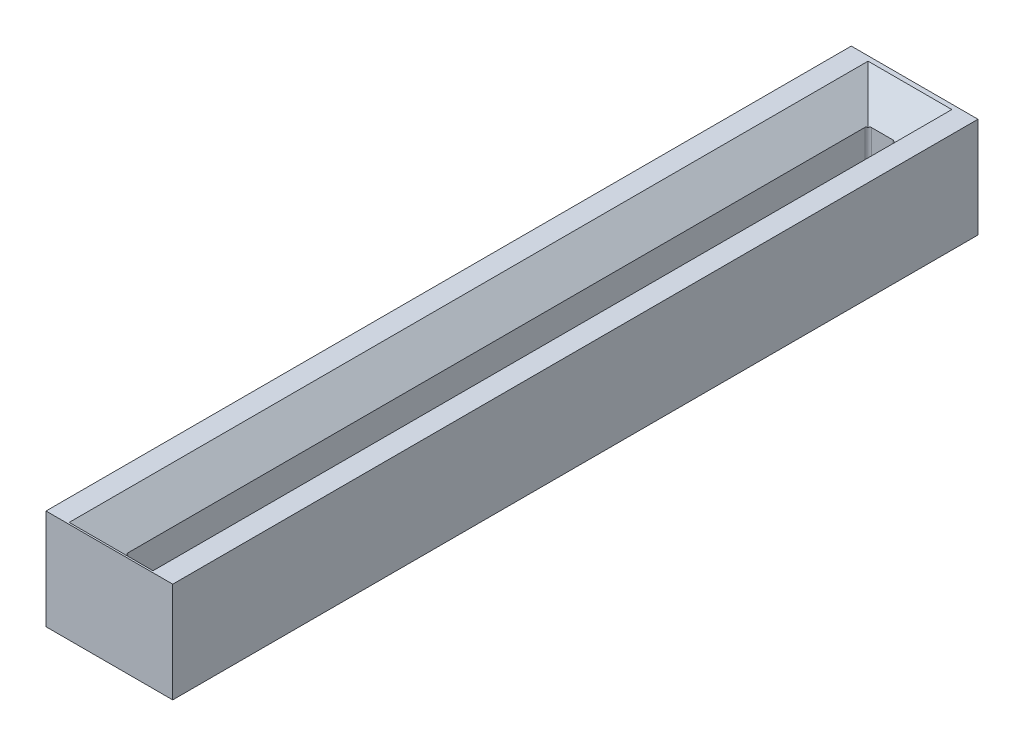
SolidWorks part; units mm, degrees
ref_plane "Front Plane" through (0, 0, 0) normal (1, 0, 0) x (0, 1, 0)
ref_plane "Top Plane" through (0, 0, 0) normal (0, 0, 1) x (0, 1, 0)
ref_plane "Right Plane" through (0, 0, 0) normal (0, 1, 0) x (-1, 0, 0)
sketch "beam" plane through (0, 0, 0) normal (0, 1, 0) x (-1, 0, 0)
  line L1 (-50.8, 1500) -> (50.8, 1500)
  line L2 (-50.8, 1500) -> (-50.8, -1500)
  line L3 (-50.8, -1500) -> (50.8, -1500)
  line L4 (50.8, 1500) -> (50.8, -1500)
  line L5 (-50.8, 1500) -> (50.8, -1500) construction
  line L6 (-50.8, -1500) -> (50.8, 1500) construction
  point P0 (0, 0)
  dimension "D1" = 3000
  dimension "D2" = 101.6
sketch "Sketch3" plane through (0, 0, 0) normal (0, 1, 0) x (-1, 0, 0)
  line L1 (-190.5, 1639.7) -> (190.5, 1639.7) construction
  line L2 (-190.5, 1639.7) -> (-190.5, -1639.7) construction
  line L3 (-190.5, -1639.7) -> (190.5, -1639.7) construction
  line L4 (190.5, 1639.7) -> (190.5, -1639.7) construction
  line L5 (-190.5, 1639.7) -> (190.5, -1639.7) construction
  line L6 (-190.5, -1639.7) -> (190.5, 1639.7) construction
  line L8 (-50.8, 1500) -> (50.8, 1500) construction
  line L9 (-50.8, 1500) -> (-50.8, -1500) construction
  circle A0 centre (-220.6625, 1669.8625) radius 30.1625
  circle A2 centre (220.6625, 1669.8625) radius 30.1625
  circle A3 centre (-220.6625, 1399.8625) radius 30.1625
  circle A4 centre (220.6625, 1399.8625) radius 30.1625
  circle A5 centre (-220.6625, 1129.8625) radius 30.1625
  circle A6 centre (220.6625, 1129.8625) radius 30.1625
  circle A7 centre (-220.6625, 859.8625) radius 30.1625
  circle A8 centre (220.6625, 859.8625) radius 30.1625
  circle A9 centre (-220.6625, 589.8625) radius 30.1625
  circle A10 centre (220.6625, 589.8625) radius 30.1625
  circle A11 centre (-220.6625, -1669.8625) radius 30.1625
  circle A12 centre (220.6625, -1669.8625) radius 30.1625
  circle A13 centre (-220.6625, -1399.8625) radius 30.1625
  circle A14 centre (220.6625, -1399.8625) radius 30.1625
  circle A15 centre (-220.6625, -1129.8625) radius 30.1625
  circle A16 centre (220.6625, -1129.8625) radius 30.1625
  circle A17 centre (-220.6625, -859.8625) radius 30.1625
  circle A18 centre (220.6625, -859.8625) radius 30.1625
  circle A19 centre (-220.6625, -589.8625) radius 30.1625
  circle A20 centre (220.6625, -589.8625) radius 30.1625
  circle A21 centre (-220.6625, -319.8625) radius 30.1625
  circle A22 centre (220.6625, -319.8625) radius 30.1625
  circle A25 centre (-220.6625, 319.8625) radius 30.1625
  circle A26 centre (220.6625, 319.8625) radius 30.1625
  point P2 (0, 0)
  dimension "D1" = 60.325
  dimension "D4" = 6
  dimension "D5" = 60.325
  dimension "D6" = 60.325
  dimension "D7" = 60.325
  dimension "D2" = 139.7
  dimension "D3" = 139.7
  dimension "D8" = 6
sketch "Sketch2" plane through (0, 0, 0) normal (0, 1, 0) x (-1, 0, 0)
  line L5 (-256.825, 1706.025) -> (256.825, 1706.025)
  line L6 (-256.825, 1706.025) -> (-256.825, -1706.025)
  line L7 (-256.825, -1706.025) -> (256.825, -1706.025)
  line L8 (56.8, 1506) -> (-56.8, 1506)
  line L9 (-56.8, 1506) -> (-56.8, -1506)
  line L10 (-56.8, -1506) -> (56.8, -1506)
  line L11 (56.8, -1506) -> (56.8, 1506)
  line L12 (56.8, 1506) -> (-56.8, 1506)
  line L13 (-56.8, 1506) -> (-56.8, -1506)
  line L14 (-56.8, -1506) -> (56.8, -1506)
  line L15 (56.8, -1506) -> (56.8, 1506)
  line L16 (256.825, 1706.025) -> (256.825, -1706.025)
  line L17 (-250.825, 1700.025) -> (250.825, 1700.025) construction
  line L18 (-250.825, 1700.025) -> (-250.825, -1700.025) construction
  line L19 (-250.825, -1700.025) -> (250.825, -1700.025) construction
  line L20 (250.825, 1700.025) -> (250.825, -1700.025) construction
  circle A0 centre (-220.6625, 1669.8625) radius 30.1625 construction
  circle A1 centre (-220.6625, 1399.8625) radius 30.1625 construction
  circle A2 centre (220.6625, 1669.8625) radius 30.1625 construction
  circle A3 centre (-220.6625, -1669.8625) radius 30.1625 construction
  dimension "D2" = 6
  dimension "D3" = 6
  dimension "D4" = 6
  dimension "D5" = 6
  dimension "D1" = 6
extrude "Boss-Extrude2" add sketch "Sketch2" along normal mid plane 406.4
chamfer "Chamfer1" distance 113 angle 45 8 edges at (56.8, 203.2, 0) (0, 203.2, -1506) (-56.8, 203.2, 0) (0, 203.2, 1506) (0, -203.2, -1506) (56.8, -203.2, 0) (-56.8, -203.2, 0) (0, -203.2, 1506)
fillet "Fillet1" radius 13 4 edges at (56.8, 0, 1506) (-56.8, 0, 1506) (-56.8, 0, -1506) (56.8, 0, -1506)
sketch "Sketch4" plane through (0, 0, 0) normal (0, 1, 0) x (-1, 0, 0)
  line L0 (169.8, -1619) -> (-169.8, -1619) construction
  line L1 (-579.1974, -1638) -> (799.6435, -1638)
  line L2 (-579.1974, -1638) -> (-579.1974, -1911.9137)
  line L3 (-579.1974, -1911.9137) -> (799.6435, -1911.9137)
  line L4 (799.6435, -1638) -> (799.6435, -1911.9137)
  line L5 (-169.8, 1619) -> (169.8, 1619) construction
  line L6 (-435.0391, 1913.587) -> (421.5152, 1913.587)
  line L7 (-435.0391, 1913.587) -> (-435.0391, 1626)
  line L8 (-435.0391, 1626) -> (421.5152, 1626)
  line L9 (421.5152, 1913.587) -> (421.5152, 1626)
  dimension "D1" = 1638
  dimension "D2" = 19
  dimension "D3" = 7
extrude "Cut-Extrude1" cut sketch "Sketch4" against normal through all both and the other way through all
